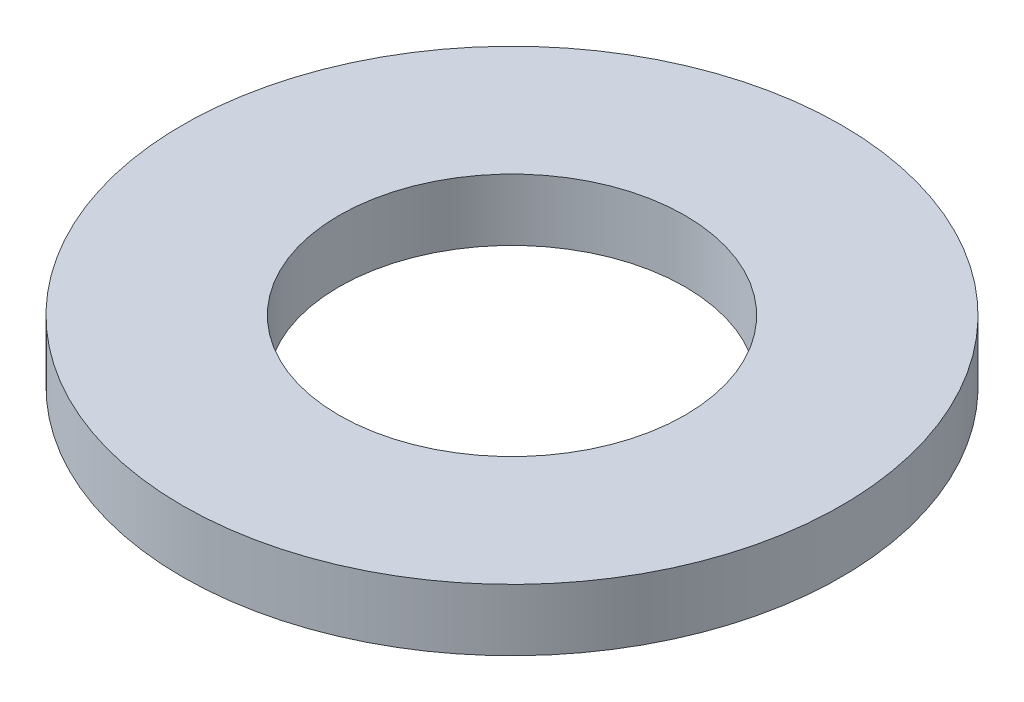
SolidWorks part; units mm, degrees
ref_plane "Plan1" through (0, 0, 0) normal (0, 0, 1) x (1, 0, 0)
ref_plane "Plan2" through (0, 0, 0) normal (0, 1, 0) x (1, 0, 0)
ref_plane "Plan3" through (0, 0, 0) normal (1, 0, 0) x (0, 0, -1)
sketch "Esquisse1" plane through (0, 0, 0) normal (0, 0, 1) x (1, 0, 0)
  line L1 (0, 0) -> (0, 2.5443) construction
  line L2 (4.2, 0) -> (4.2, 1.5)
  line L3 (4.2, 0) -> (8, 0)
  line L4 (8, 0) -> (8, 1.5)
  line L5 (8, 1.5) -> (4.2, 1.5)
  line L6 (4.2, 0) -> (-4.2, 0) construction
  line L7 (8, 0) -> (-8, 0) construction
revolve "Base-Révolution" add sketch "Esquisse1" angle 360 about L1
equation "\"Rext@Esquisse1\"=\"Diamètre extérieur@Esquisse1\"/2"
equation "\"Rint@Esquisse1\" = \"Diamètre de passage@Esquisse1\"/2"
